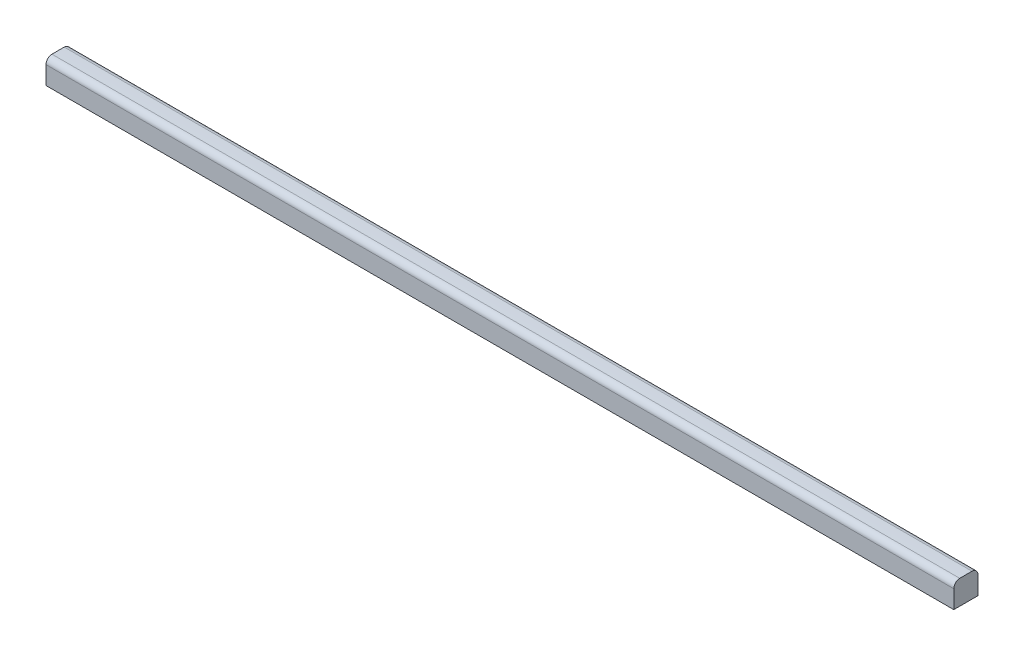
SolidWorks part; units mm, degrees
ref_plane "前视基准面" through (0, 0, 0) normal (0, 0, 1) x (1, 0, 0)
ref_plane "上视基准面" through (0, 0, 0) normal (0, 1, 0) x (1, 0, 0)
ref_plane "右视基准面" through (0, 0, 0) normal (1, 0, 0) x (0, 0, -1)
other "Configuration Table"
sketch "草图2" plane through (0, 0, 0) normal (1, 0, 0) x (0, 0, -1)
  line L0 (0, 71) -> (0, 75) construction
  line L1 (2, 71) -> (2, 74.9733)
  line L2 (-2, 71) -> (-2, 74.9733)
  line L3 (-2, 71) -> (2, 71)
  line L4 (2, 0) -> (2, 75) construction
  line L5 (0, 0) -> (0, 75) construction
  line L6 (-2, 0) -> (-2, 75) construction
  arc A0 (2, 74.9733) -> (-2, 74.9733) centre (0, 0) ccw
  dimension "D1" = 150
  dimension "D4" = 4
  dimension "D2" = 2
  dimension "D3" = 2
extrude "凸台-拉伸1" add sketch "草图2" along normal blind 150
fillet "圆角1" radius 1 2 edges at (75, 74.9733, -2) (75, 74.9733, 2)
